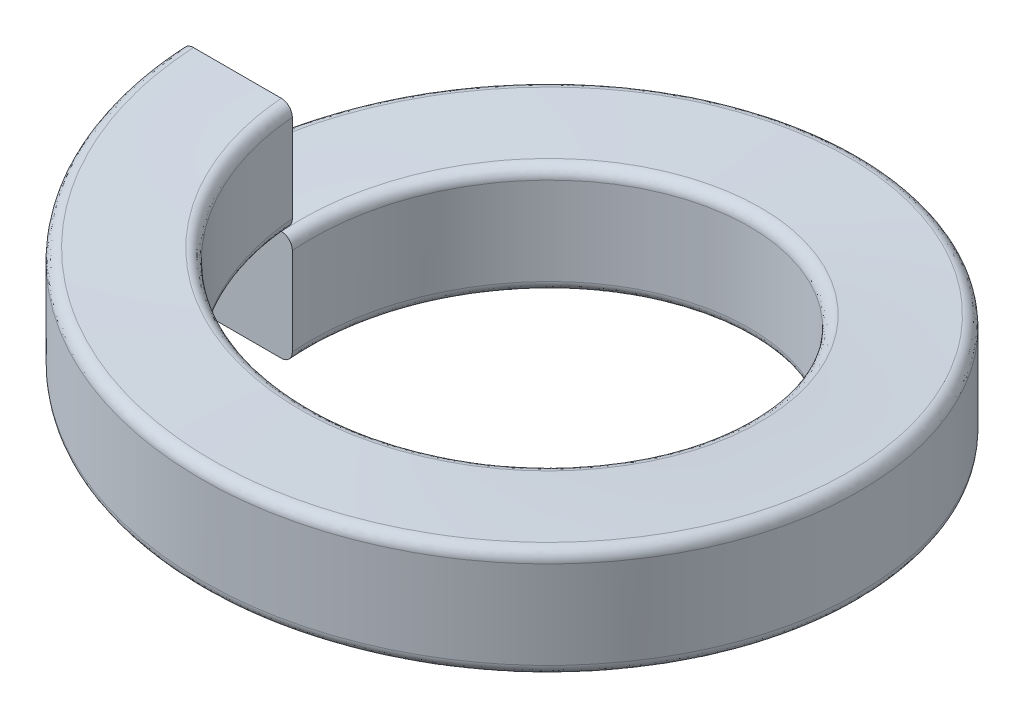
SolidWorks part; units mm, degrees
ref_plane "前视基准面" through (0, 0, 0) normal (0, 0, 1) x (1, 0, 0)
ref_plane "上视基准面" through (0, 0, 0) normal (0, 1, 0) x (1, 0, 0)
ref_plane "右视基准面" through (0, 0, 0) normal (1, 0, 0) x (0, 0, -1)
sketch "草图4" plane through (0, 0, 0) normal (0, 1, 0) x (1, 0, 0)
  circle A0 centre (0, 0) radius 5
  dimension "D1" = 10
sketch "草图5" plane through (0, 0, 0) normal (0, 1, 0) x (1, 0, 0)
  circle A0 centre (0, 0) radius 5
  dimension "D1" = 10
curve "螺旋线/涡状线1"
sketch "草图6" plane through (0, 0, 0) normal (0, 0, 1) x (1, 0, 0)
  line L1 (-6, 1) -> (-4, 1)
  line L2 (-6, 1) -> (-6, -1)
  line L3 (-6, -1) -> (-4, -1)
  line L4 (-4, 1) -> (-4, -1)
  line L5 (-6, 1) -> (-4, -1) construction
  line L6 (-6, -1) -> (-4, 1) construction
  spline S0 degree 3 poles (-5, 0) (-5, 0.0435) (-4.7397, 0.1314) (-3.6276, 0.2625) (-1.9632, 0.3938) (0, 0.525) (1.9632, 0.6563) (3.6276, 0.7875) (4.7397, 0.9188) (5.1302, 1.05) (4.7397, 1.1812) (3.6276, 1.3125) (1.9632, 1.4437) (0, 1.575) (-1.9632, 1.7062) (-3.6276, 1.8375) (-4.7397, 1.9686) (-5, 2.0565) (-5, 2.1) knots 0 0 0 0 0.0625 0.125 0.1875 0.25 0.3125 0.375 0.4375 0.5 0.5625 0.625 0.6875 0.75 0.8125 0.875 0.9375 1 1 1 1 construction
  point P0 (-5, 0)
  dimension "D1" = 2
  dimension "D2" = 2
sweep "扫描1" add profiles "草图6" path "螺旋线/涡状线1"
fillet "圆角1" radius 0.2 4 edges
